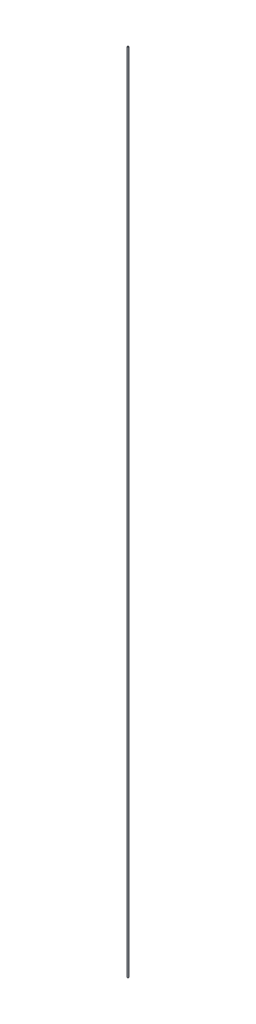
SolidWorks part; units mm, degrees
ref_plane "Plan de face" through (0, 0, 0) normal (0, 0, 1) x (1, 0, 0)
ref_plane "Plan de dessus" through (0, 0, 0) normal (0, 1, 0) x (1, 0, 0)
ref_plane "Plan de droite" through (0, 0, 0) normal (1, 0, 0) x (0, 0, -1)
sketch "Esquisse1" plane through (0, 0, 0) normal (0, 1, 0) x (1, 0, 0)
  circle A0 centre (0, 0) radius 1.5
  dimension "D1" = 3
extrude "Extrusion1" add sketch "Esquisse1" along normal blind 1980
